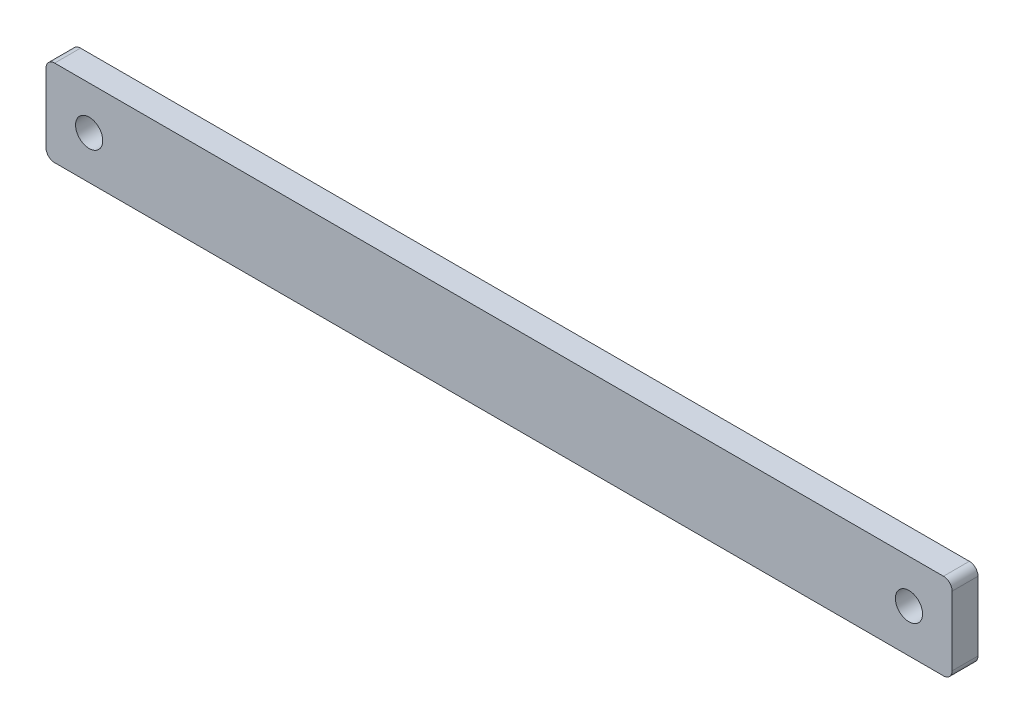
SolidWorks part; units mm, degrees
ref_plane "Front Plane" through (0, 0, 0) normal (0, 0, 1) x (1, 0, 0)
ref_plane "Top Plane" through (0, 0, 0) normal (0, 1, 0) x (1, 0, 0)
ref_plane "Right Plane" through (0, 0, 0) normal (1, 0, 0) x (0, 0, -1)
sketch "Sketch1" plane through (0, 0, 0) normal (0, 0, 1) x (1, 0, 0)
  line L1 (0, 0) -> (266.7, 0)
  line L2 (0, 0) -> (0, 25.4)
  line L3 (0, 25.4) -> (266.7, 25.4)
  line L4 (266.7, 0) -> (266.7, 25.4)
  dimension "D1" = 25.4
  dimension "D2" = 266.7
extrude "Boss-Extrude1" add sketch "Sketch1" along normal blind 7.62
sketch "Sketch2" plane through (0, 0, 7.62) normal (0, 0, 1) x (1, 0, 0)
  line L0 (266.7, 12.7) -> (0, 12.7) construction
  line L1 (266.7, 0) -> (266.7, 25.4) construction
  line L2 (0, 25.4) -> (0, 0) construction
  circle A0 centre (12.7, 12.7) radius 4
  dimension "D1" = 8
  dimension "D2" = 12.7
extrude "Cut-Extrude1" cut sketch "Sketch2" against normal through all
ref_plane "Plane1" through (133.35, 0, 0) normal (1, 0, 0) x (0, 0, -1)
mirror "Mirror1" about plane through (133.35, 0, 0) normal (1, 0, 0) of "Cut-Extrude1"
fillet "Fillet1" radius 2.54 4 edges at (0, 25.4, 3.81) (0, 0, 3.81) (266.7, 0, 3.81) (266.7, 25.4, 3.81)
